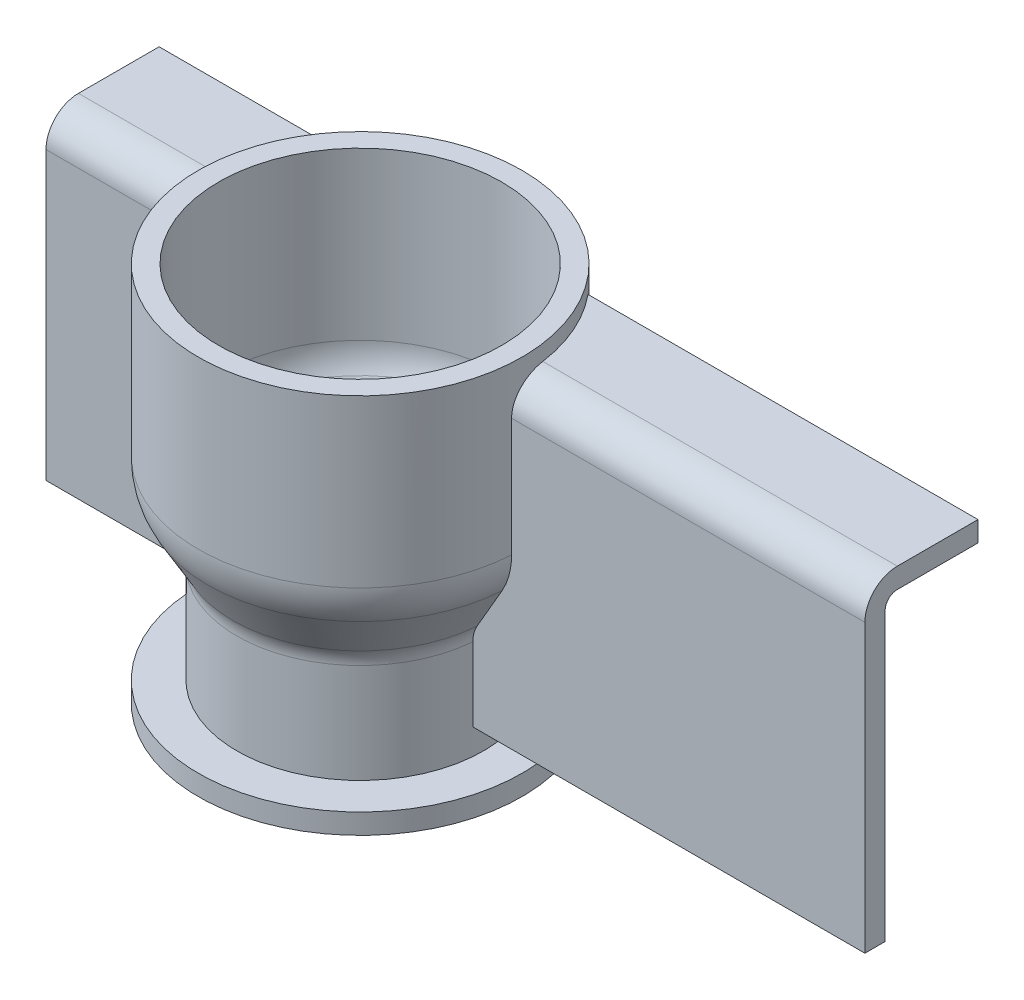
SolidWorks part; units mm, degrees
ref_plane "Front Plane" through (0, 0, 0) normal (0, 0, 1) x (1, 0, 0)
ref_plane "Top Plane" through (0, 0, 0) normal (0, 1, 0) x (1, 0, 0)
ref_plane "Right Plane" through (0, 0, 0) normal (1, 0, 0) x (0, 0, -1)
sketch "strainer" plane through (0, 0, 0) normal (0, 0, 1) x (1, 0, 0)
  line L0 (0, 0) -> (0, 47.8971) construction
  line L2 (-34.925, 0) -> (-34.925, -41.047)
  line L3 (-33.2235, -47.397) -> (-27.1015, -58.0007)
  line L4 (-25.4, -64.3507) -> (-25.4, -88.9)
  arc A0 (-25.4, -64.3507) -> (-27.1015, -58.0007) centre (-38.1, -64.3507) ccw
  arc A1 (-33.2235, -47.397) -> (-34.925, -41.047) centre (-22.225, -41.047) cw
  point P9 (-25.4, -60.9478)
  dimension "D6" = 12.7
  dimension "D1" = 69.85
  dimension "D2" = 27.9522
  dimension "D3" = 88.9
  dimension "D4" = 50.8
  dimension "D5" = 30
ref_plane "bracket.start" through (127, 0, 0) normal (1, 0, 0) x (0, 0, -1)
sketch "bracket" plane through (127, 0, 0) normal (1, 0, 0) x (0, 0, -1)
  line L0 (0, -6.35) -> (0, -82.55)
  line L1 (0, -6.35) -> (25.4, -6.35)
  dimension "D1" = 6.35
  dimension "D2" = 25.4
  dimension "D3" = 76.2
revolve "Revolve-Thin1" add sketch "strainer" angle 360 about L0
extrude "Extrude-Thin1" add sketch "bracket" against normal up to next thin
sketch "Sketch1" plane through (0, -88.9, 0) normal (0, -1, 0) x (1, 0, 0)
  circle A0 centre (0, 0) radius 39.925 construction
  circle A1 centre (0, 0) radius 39.925
extrude "Boss-Extrude1" add sketch "Sketch1" along normal blind 5
ref_plane "Plane1" through (-75, 0, 0) normal (1, 0, 0) x (0, 0, -1)
sketch "Sketch2" plane through (-75, 0, 0) normal (1, 0, 0) x (0, 0, -1)
  line L6 (5.5, -8.85) -> (25.4, -8.85)
  line L7 (25.4, -8.85) -> (25.4, -3.85)
  line L8 (25.4, -3.85) -> (5.5, -3.85)
  line L9 (-2.5, -11.85) -> (-2.5, -82.55)
  line L10 (-2.5, -82.55) -> (2.5, -82.55)
  line L11 (2.5, -82.55) -> (2.5, -11.85)
  line L12 (5.5, -8.85) -> (25.4, -8.85)
  line L13 (25.4, -8.85) -> (25.4, -3.85)
  line L14 (25.4, -3.85) -> (5.5, -3.85)
  line L15 (-2.5, -11.85) -> (-2.5, -82.55)
  line L16 (-2.5, -82.55) -> (2.5, -82.55)
  line L17 (2.5, -82.55) -> (2.5, -11.85)
  arc A2 (5.5, -3.85) -> (-2.5, -11.85) centre (5.5, -11.85) ccw
  arc A3 (5.5, -8.85) -> (2.5, -11.85) centre (5.5, -11.85) ccw
  arc A4 (5.5, -3.85) -> (-2.5, -11.85) centre (5.5, -11.85) ccw
  arc A5 (5.5, -8.85) -> (2.5, -11.85) centre (5.5, -11.85) ccw
  dimension "D1" = 0
extrude "Boss-Extrude2" add sketch "Sketch2" along normal up to next
